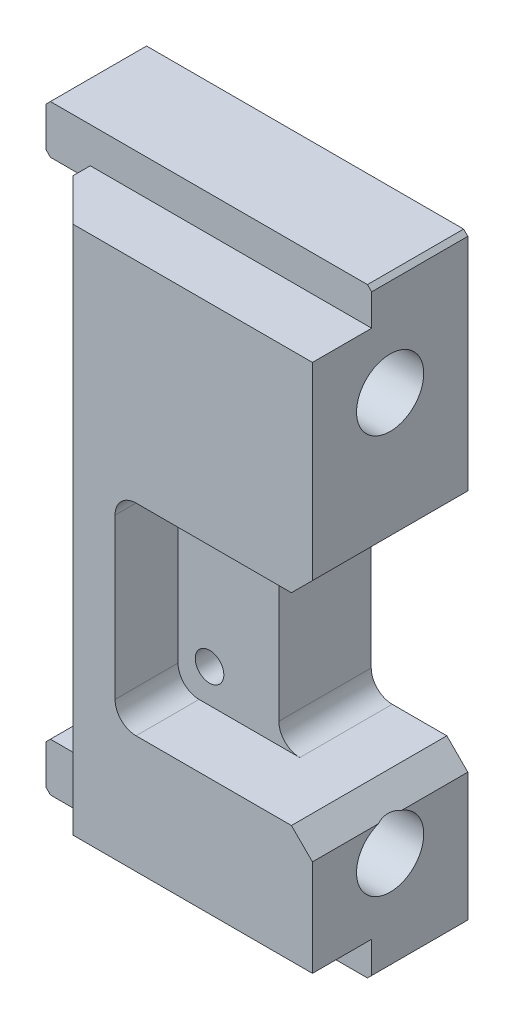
SolidWorks part; units mm, degrees
ref_plane "Plan de face" through (0, 0, 0) normal (0, 0, 1) x (1, 0, 0)
ref_plane "Plan de dessus" through (0, 0, 0) normal (0, 1, 0) x (1, 0, 0)
ref_plane "Plan de droite" through (0, 0, 0) normal (1, 0, 0) x (0, 0, -1)
sketch "Esquisse1"
  dimension "D1" = 12.5
  dimension "D2" = 34.5
  dimension "D3" = 16
  dimension "D4" = 16
  dimension "D5" = 38
sketch "Esquisse2" plane through (0, 0, 0) normal (0, 0, 1) x (1, 0, 0)
  line L0 (-314.7866, 295.8741) -> (-314.7866, 175.8741)
  line L1 (-324.2866, 175.8741) -> (-314.7866, 175.8741)
  line L2 (-324.2866, 175.8741) -> (-325.2866, 174.8741)
  line L3 (-325.2866, 174.8741) -> (-325.2866, 165.3741)
  line L4 (-325.2866, 165.3741) -> (-324.2866, 164.3741)
  line L5 (-324.2866, 164.3741) -> (-248.7866, 164.3741)
  line L6 (-248.7866, 164.3741) -> (-247.7866, 165.3741)
  line L7 (-247.7866, 195.8741) -> (-247.7866, 165.3741)
  line L8 (-252.7866, 200.8741) -> (-247.7866, 195.8741)
  line L9 (-265.7866, 200.8741) -> (-252.7866, 200.8741)
  line L10 (-270.7866, 243.8741) -> (-270.7866, 205.8741)
  line L11 (-265.7866, 248.8741) -> (-252.7866, 248.8741)
  line L12 (-252.7866, 248.8741) -> (-247.7866, 253.8741)
  line L13 (-314.7866, 295.8741) -> (-324.2866, 295.8741)
  line L14 (-324.2866, 295.8741) -> (-325.2866, 296.8741)
  line L15 (-325.2866, 306.3741) -> (-325.2866, 296.8741)
  line L16 (-325.2866, 306.3741) -> (-324.2866, 307.3741)
  line L17 (-324.2866, 307.3741) -> (-248.7866, 307.3741)
  line L18 (-248.7866, 307.3741) -> (-247.7866, 306.3741)
  line L19 (-247.7866, 306.3741) -> (-247.7866, 253.8741)
  arc A0 (-265.7866, 248.8741) -> (-270.7866, 243.8741) centre (-265.7866, 243.8741) ccw
  arc A1 (-265.7866, 200.8741) -> (-270.7866, 205.8741) centre (-265.7866, 205.8741) cw
extrude "Boss.-Extru.1" add sketch "Esquisse2" along normal blind 37
sketch "Esquisse3" plane through (0, 0, 37) normal (0, 0, 1) x (1, 0, 0)
  line L0 (-265.7866, 248.8741) -> (-289.7866, 248.8741)
  line L1 (-294.7866, 243.8741) -> (-294.7866, 205.8741)
  line L2 (-289.7866, 200.8741) -> (-274.7866, 200.8741)
  line L3 (-274.7866, 200.8741) -> (-265.7866, 200.8741)
  line L4 (-265.7866, 200.8741) -> (-265.7866, 248.8741)
  arc A0 (-289.7866, 248.8741) -> (-294.7866, 243.8741) centre (-289.7866, 243.8741) ccw
  arc A1 (-294.7866, 205.8741) -> (-289.7866, 200.8741) centre (-289.7866, 205.8741) ccw
extrude "Enlèv. mat.-Extru.1" cut sketch "Esquisse3" against normal blind 15
sketch "Esquisse4" plane through (-247.7866, 0, 0) normal (1, 0, 0) x (0, 0, -1)
  line L0 (0, 235.8741) -> (0, 305.8741) construction
  line L1 (0, 235.8741) -> (0, 165.8741) construction
  line L2 (-22, 200.8741) -> (0, 200.8741) construction
  line L5 (-22, 248.8741) -> (-37, 248.8741) construction
  circle A0 centre (-18.5, 283.3741) radius 8
  circle A1 centre (-18.5, 188.3741) radius 8
  point P8 (-11, 200.8741)
  dimension "D5" = 16
  dimension "D6" = 16
  dimension "D1" = 18.5
  dimension "D2" = 18.5
  dimension "D3" = 12.5
  dimension "D4" = 34.5
chamfer "Chanfrein1" distance 10 angle 45 1 edges at (-314.7866, 235.8741, 37)
hole_wizard "Trou taraudé M81" positions "Esquisse6" profile "Esquisse5" tap size "M8" standard "ISO"
sketch "Esquisse6" plane through (0, 0, 22) normal (0, 0, 1) x (1, 0, 0)
  line L0 (-287.2866, 202.2741) -> (-287.2866, 215.4741) construction
  line L1 (-252.7866, 248.8741) -> (-289.7866, 248.8741) construction
  circle A3 centre (-287.2866, 208.8741) radius 5 construction
  point P1 (-287.2866, 240.8741)
  point P4 (-287.2866, 208.8741)
  dimension "D1" = 40
sketch "Esquisse5" plane through (-287.2866, 240.8741, 22) normal (1, 0, 0) x (0, -1, 0)
  line L0 (0, 0) -> (0, 24.2929)
  line L1 (0, 24.2929) -> (3.4, 22.25)
  line L2 (3.4, 22.25) -> (3.4, 0)
  line L5 (3.4, 0) -> (0, 0)
  line L10 (0, 24.2929) -> (-3.4, 22.25) construction
  line L11 (0, -6.35) -> (0, 107.95) construction
  dimension "Diamètre du trou pour taraudage" = 6.8
  dimension "Profondeur du trou pour taraudage" = 22.25
  dimension "Angle de pointe" = 118
sketch "Esquisse7" plane through (0, 0, 37) normal (0, 0, 1) x (1, 0, 0)
  line L0 (-247.7866, 253.8741) -> (-247.7866, 306.3741) construction
  line L1 (-247.7866, 298.8741) -> (-328.1395, 298.8741)
  line L2 (-247.7866, 298.8741) -> (-247.7866, 314.6349)
  line L3 (-247.7866, 314.6349) -> (-328.1395, 314.6349)
  line L4 (-328.1395, 298.8741) -> (-328.1395, 314.6349)
  line L5 (-248.7866, 307.3741) -> (-324.2866, 307.3741) construction
  line L6 (-247.7866, 165.3741) -> (-247.7866, 195.8741) construction
  line L7 (-247.7866, 172.8741) -> (-344.9254, 172.8741)
  line L8 (-247.7866, 172.8741) -> (-247.7866, 149.2287)
  line L9 (-247.7866, 149.2287) -> (-344.9254, 149.2287)
  line L10 (-344.9254, 172.8741) -> (-344.9254, 149.2287)
  line L11 (-324.2866, 164.3741) -> (-248.7866, 164.3741) construction
  dimension "D1" = 8.5
  dimension "D2" = 8.5
extrude "Enlèv. mat.-Extru.2" cut sketch "Esquisse7" against normal blind 14.1
hole_wizard "Diamètre du perçage Ø8.0 (8)1" positions "Esquisse10" profile "Esquisse9" hole size "Ø8.0" standard "Iso"
sketch "Esquisse10" plane through (-247.7866, 0, 0) normal (1, 0, 0) x (0, 0, -1)
  line L0 (0, 165.3741) -> (0, 195.8741) construction
  line L1 (0, 253.8741) -> (0, 306.3741) construction
  line L2 (-22.9, 164.3741) -> (0, 164.3741) construction
  point P0 (-18.5, 188.3741)
  point P2 (-18.5, 283.3741)
  dimension "D1" = 18.5
  dimension "D2" = 18.5
  dimension "D3" = 24
  dimension "D4" = 95
sketch "Esquisse9" plane through (-247.7866, 188.3741, 18.5) normal (0, 1, 0) x (0, 0, -1)
  line L0 (0, 0) -> (0, 40.4034)
  line L1 (0, 40.4034) -> (4, 38)
  line L2 (4, 38) -> (4, 0)
  line L5 (4, 0) -> (0, 0)
  line L10 (0, 40.4034) -> (-4, 38) construction
  line L11 (0, -6.35) -> (0, 107.95) construction
  dimension "Diamètre du perçage" = 8
  dimension "Profondeur du perçage" = 38
  dimension "Angle de pointe" = 118
extrude "Enlèv. mat.-Extru.3" cut sketch "Esquisse4" against normal blind 35
sketch "Esquisse8" plane through (0, 172.8741, 0) normal (0, -1, 0) x (1, 0, 0)
  line L0 (-304.7866, 37) -> (-314.7866, 27)
  line L1 (-314.7866, 27) -> (-314.7866, 22.9)
  line L2 (-248.7866, 22.9) -> (-324.2866, 22.9) construction
  line L3 (-314.7866, 27) -> (-314.7866, 0) construction
  line L4 (-314.7866, 22.9) -> (-325.2866, 22.9)
  line L5 (-325.2866, 22.9) -> (-325.2866, 37)
  line L6 (-325.2866, 37) -> (-304.7866, 37)
extrude "Enlèv. mat.-Extru.4" cut sketch "Esquisse8" against normal through all
